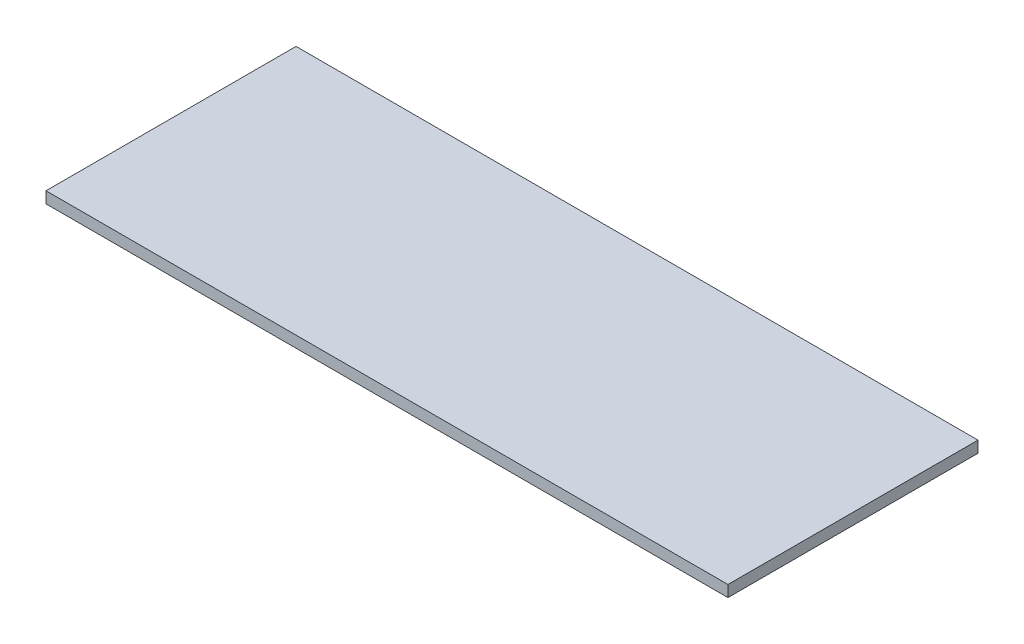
SolidWorks part; units mm, degrees
ref_plane "Front" through (0, 0, 0) normal (0, 0, 1) x (1, 0, 0)
ref_plane "Top" through (0, 0, 0) normal (0, 1, 0) x (1, 0, 0)
ref_plane "Right" through (0, 0, 0) normal (1, 0, 0) x (0, 0, -1)
sketch "Sketch1" plane through (0, 0, 0) normal (0, 1, 0) x (1, 0, 0)
  line L1 (150, -55) -> (-150, -55)
  line L2 (150, -55) -> (150, 55)
  line L3 (150, 55) -> (-150, 55)
  line L4 (-150, -55) -> (-150, 55)
  line L5 (150, -55) -> (-150, 55) construction
  line L6 (150, 55) -> (-150, -55) construction
  point P0 (0, 0)
  dimension "D1" = 300
  dimension "D2" = 110
extrude "Boss-Extrude1" add sketch "Sketch1" against normal blind 5
